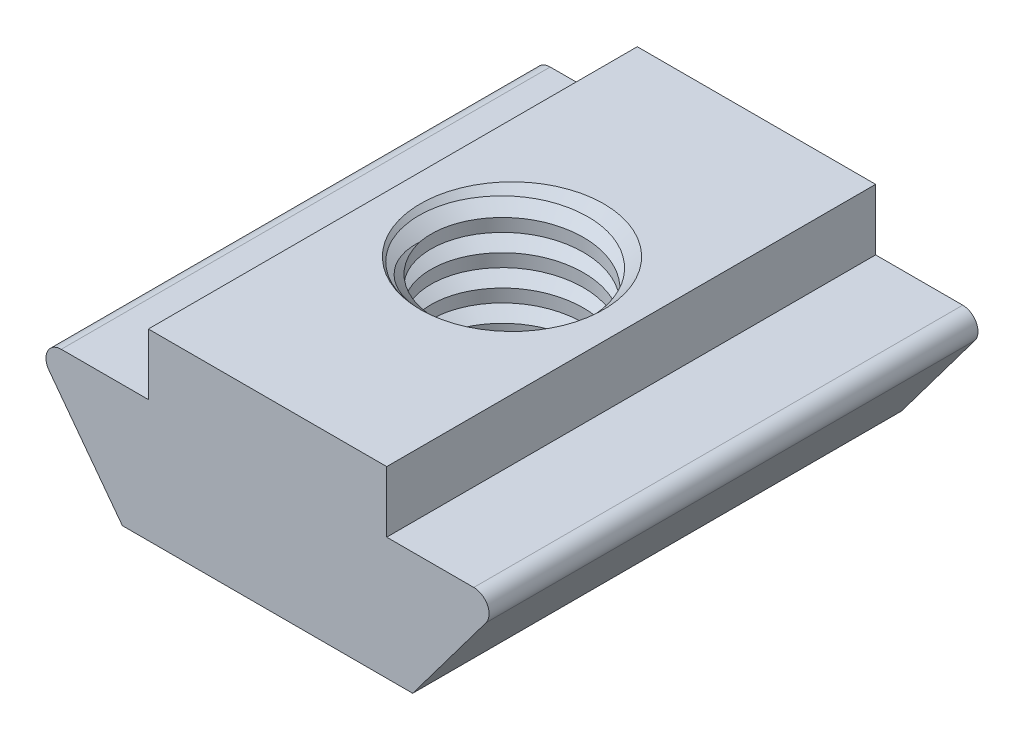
SolidWorks part; units mm, degrees
ref_plane "前视基准面" through (0, 0, 0) normal (0, 0, 1) x (1, 0, 0)
ref_plane "上视基准面" through (0, 0, 0) normal (0, 1, 0) x (1, 0, 0)
ref_plane "右视基准面" through (0, 0, 0) normal (1, 0, 0) x (0, 0, -1)
sketch "草图1" plane through (0, 0, 0) normal (0, 0, 1) x (1, 0, 0)
  line L0 (-3.9, 4) -> (-3.9, 6)
  line L1 (-3.9, 6) -> (3.9, 6)
  line L2 (3.9, 6) -> (3.9, 4)
  line L3 (3.9, 4) -> (7.75, 4)
  line L4 (7.75, 4) -> (4.75, 0)
  line L5 (4.75, 0) -> (-4.75, 0)
  line L6 (-4.75, 0) -> (-7.75, 4)
  line L7 (-7.75, 4) -> (-3.9, 4)
  dimension "D1" = 7.8
  dimension "D2" = 3.85
  dimension "D3" = 6
  dimension "D4" = 3.85
  dimension "D5" = 5
  dimension "D6" = 2
  dimension "D7" = 5
extrude "凸台-拉伸1" add sketch "草图1" along normal mid plane 16
sketch "草图7" plane through (0, 6, 0) normal (0, 1, 0) x (1, 0, 0)
  line L0 (0, 8.8) -> (0, -12.1488) construction
  line L1 (3.9, 8) -> (-3.9, 8) construction
  circle A0 centre (0, 0) radius 2.5
  dimension "D1" = 5
  dimension "D2" = 8
sketch "草图9" plane through (0, 6, 0) normal (0, 1, 0) x (1, 0, 0)
  circle A0 centre (0, 0) radius 3
  dimension "D1" = 6
extrude "切除-拉伸2" cut sketch "草图7" against normal blind 16 contours A0
chamfer "倒角2" distance 0.5 angle 45 2 edges at (-2.5, 0, 0) (-2.5, 6, 0)
curve "螺旋线/涡状线2"
sketch "草图11" plane through (0, 0, 0) normal (1, 0, 0) x (0, 0, -1)
  line L0 (-8, 6) -> (8, 6) construction
  line L1 (-3, 6) -> (-1.5685, 5.1735)
  line L2 (-1.5685, 5.1735) -> (-1.5685, 6.8265)
  line L3 (-1.5685, 6.8265) -> (-3, 6)
  circle A0 centre (-2.0457, 6) radius 0.4772 construction
sweep "切除-扫描3" cut profiles "草图11" path "螺旋线/涡状线2"
fillet "圆角2" radius 0.5 2 edges at (-7.75, 4, 0) (7.75, 4, 0)
